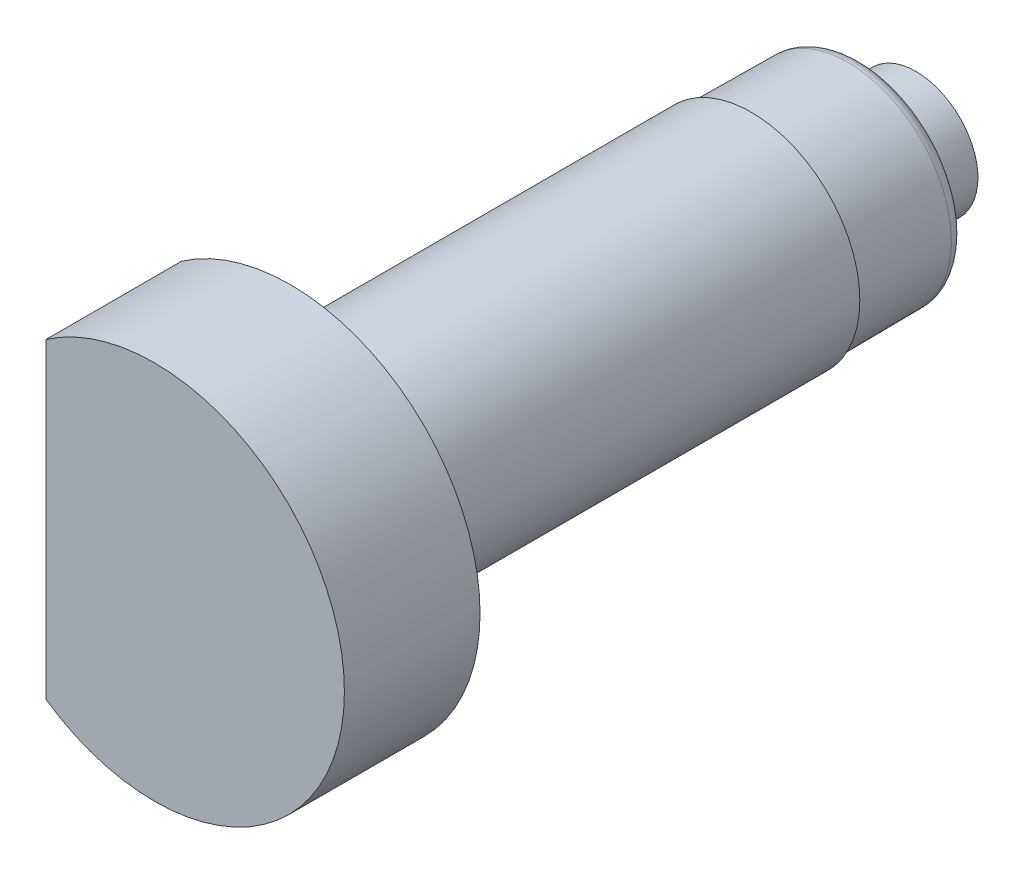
SolidWorks part; units mm, degrees
ref_plane "Plan de face" through (0, 0, 0) normal (0, 0, 1) x (1, 0, 0)
ref_plane "Plan de dessus" through (0, 0, 0) normal (0, 1, 0) x (1, 0, 0)
ref_plane "Plan de droite" through (0, 0, 0) normal (1, 0, 0) x (0, 0, -1)
imported_body "Importée1"
fillet "Congé1" radius 0.5
